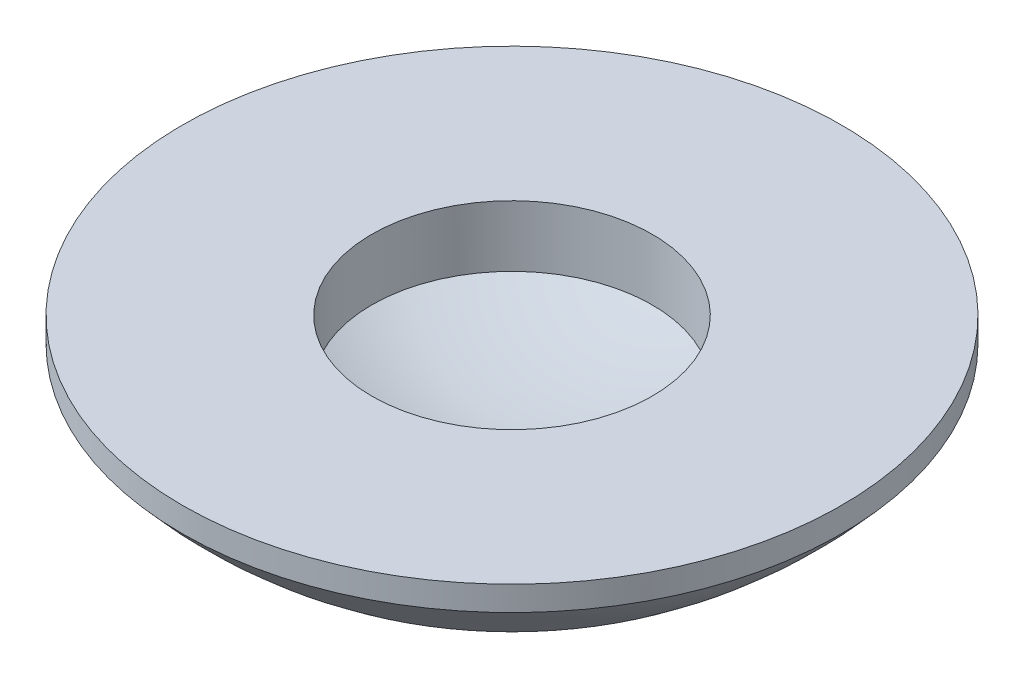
SolidWorks part; units mm, degrees
ref_plane "Front Plane" through (0, 0, 0) normal (0, 0, 1) x (1, 0, 0)
ref_plane "Top Plane" through (0, 0, 0) normal (0, 1, 0) x (1, 0, 0)
ref_plane "Right Plane" through (0, 0, 0) normal (1, 0, 0) x (0, 0, -1)
sketch "Sketch1" plane through (0, 0, 0) normal (0, 0, 1) x (1, 0, 0)
  line L0 (0, -1.6073) -> (0, -1.9073)
  line L2 (-0.4872, -1.404) -> (-0.9276, -1.404) construction
  line L3 (-0.4872, -1.404) -> (-0.4872, -1.504)
  line L4 (-0.4872, -1.404) -> (-0.4872, -1.2914)
  line L5 (0, -1.6073) -> (0, -0.4073) construction
  line L6 (-0.4872, -1.2914) -> (-1.1446, -1.2914)
  line L7 (-1.1446, -1.3768) -> (-1.1446, -1.2914)
  arc A0 (-0.4872, -1.504) -> (0, -1.6073) centre (0, -0.4073) ccw
  circle A1 centre (0, -0.4073) radius 1.2 construction
  circle A2 centre (0, -0.4073) radius 1.5 construction
  circle A3 centre (0, 18.34) radius 19.75 construction
  arc A4 (-1.1446, -1.3768) -> (-0.4872, -1.404) centre (0, 18.34) ccw construction
  arc A5 (-1.1446, -1.3768) -> (0, -1.9073) centre (0, -0.4073) ccw
  dimension "D2" = 0.4872
  dimension "D4" = 0.3
  dimension "D5" = 39.5
  dimension "D1" = 1.2
  dimension "D3" = 0.1
revolve "Revolve2" add sketch "Sketch1" angle 360 about L0
